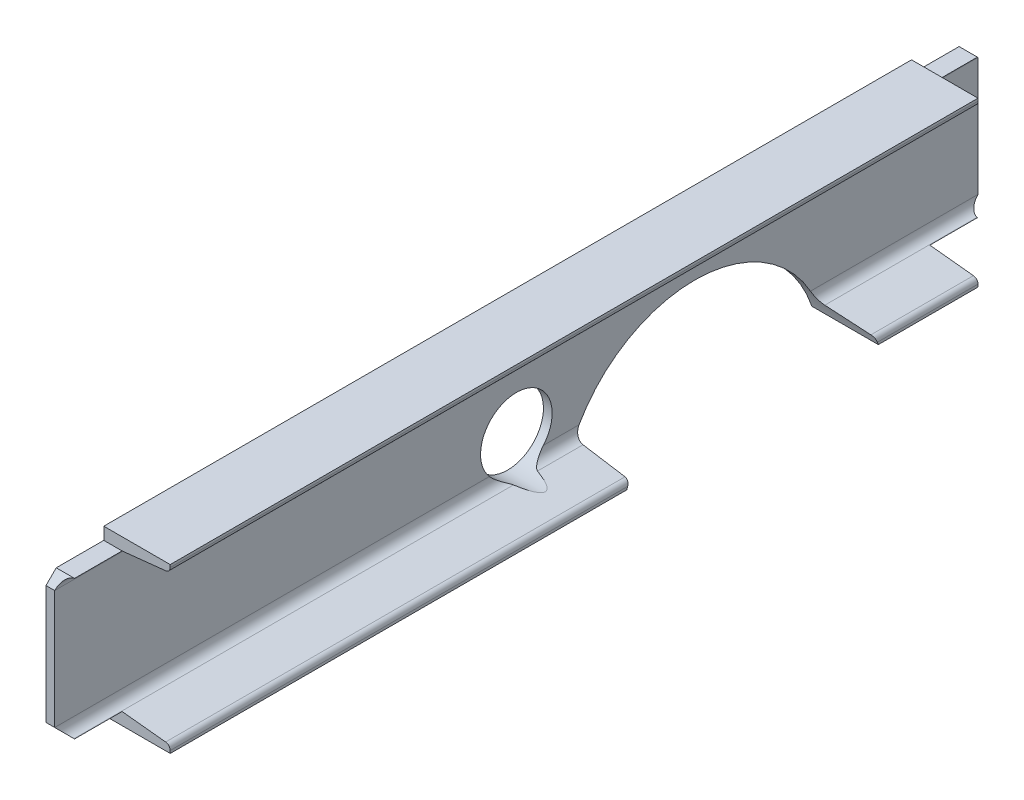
SolidWorks part; units mm, degrees
ref_plane "前视基准面" through (0, 0, 0) normal (0, 0, 1) x (1, 0, 0)
ref_plane "上视基准面" through (0, 0, 0) normal (0, 1, 0) x (1, 0, 0)
ref_plane "右视基准面" through (0, 0, 0) normal (1, 0, 0) x (0, 0, -1)
sketch "草图1" plane through (0, 0, 0) normal (0, 0, 1) x (1, 0, 0)
  line L0 (65, 80) -> (0, 80)
  line L1 (0, 80) -> (0, -80)
  line L2 (0, -80) -> (65, -80)
  line L3 (65, -80) -> (65, -77.4971)
  line L4 (60.528, -72.5251) -> (17.444, -67.9498)
  line L5 (8.5, -58.0057) -> (8.5, 58.0057)
  line L6 (17.444, 67.9498) -> (60.528, 72.5251)
  line L7 (65, 77.4971) -> (65, 80)
  line L8 (36.75, 80) -> (36.75, 70) construction
  line L9 (36.75, -70) -> (36.75, -80) construction
  arc A0 (8.5, 58.0057) -> (17.444, 67.9498) centre (18.5, 58.0057) cw
  arc A1 (17.444, -67.9498) -> (8.5, -58.0057) centre (18.5, -58.0057) cw
  arc A2 (65, 77.4971) -> (60.528, 72.5251) centre (60, 77.4971) cw
  arc A3 (65, -77.4971) -> (60.528, -72.5251) centre (60, -77.4971) ccw
  point P19 (65, 73)
  point P22 (65, -73)
  dimension "D12" = 10
  dimension "D13" = 5
  dimension "D1" = 160
  dimension "D2" = 65
  dimension "D3" = 65
  dimension "D4" = 80
  dimension "D5" = 8.5
  dimension "D6" = 7
  dimension "D7" = 7
  dimension "D8" = 28.25
  dimension "D9" = 10
  dimension "D10" = 28.25
  dimension "D11" = 10
extrude "拉伸1" add sketch "草图1" along normal mid plane 903
sketch "草图2" plane through (0, 0, 451.5) normal (0, 0, 1) x (1, 0, 0)
  line L0 (0, 80) -> (0, -80) construction
  line L1 (0, 68) -> (65, 68)
  line L2 (0, 68) -> (0, 80)
  line L3 (0, 80) -> (65, 80)
  line L4 (65, 68) -> (65, 80)
  line L6 (0, -80) -> (65, -80)
  line L7 (0, -80) -> (0, -68)
  line L8 (0, -68) -> (65, -68)
  line L9 (65, -80) -> (65, -68)
  dimension "D1" = 12
  dimension "D2" = 12
extrude "切除-拉伸1" cut sketch "草图2" against normal blind 56.5
mirror "镜向1" about plane through (0, 0, 0) normal (0, 0, 1) of "切除-拉伸1"
sketch "草图3" plane through (0, 0, 0) normal (-1, 0, 0) x (0, 0, 1)
  line L0 (-297.5285, -80) -> (-51.4715, -80)
  line L1 (395, -80) -> (-395, -80) construction
  line L2 (-451.5, 68) -> (-451.5, -68) construction
  arc A0 (-51.4715, -80) -> (-297.5285, -80) centre (-174.5, -122) ccw
  dimension "D1" = 260
  dimension "D3" = 277
  dimension "D2" = 88
extrude "切除-拉伸2" cut sketch "草图3" against normal through all
sketch "草图4" plane through (0, 0, 0) normal (-1, 0, 0) x (0, 0, 1)
  line L0 (451.5, 68) -> (451.5, -68) construction
  line L1 (395, -80) -> (-51.4715, -80) construction
  circle A0 centre (0, -35) radius 35
  dimension "D1" = 451.5
  dimension "D2" = 70
  dimension "D3" = 45
extrude "切除-拉伸3" cut sketch "草图4" against normal through all
chamfer "倒角1" distance 10 angle 45 4 edges at (8.9583, -68, -451.5) (8.9583, 68, -451.5) (8.9583, -68, 451.5) (8.9583, 68, 451.5)
